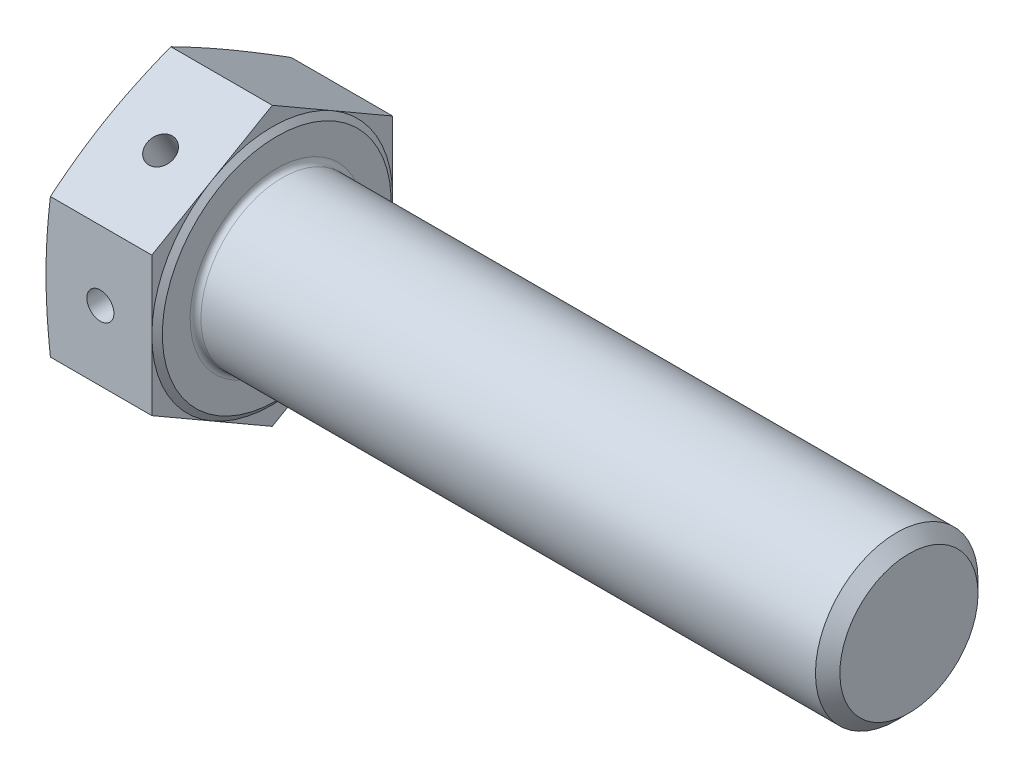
SolidWorks part; units mm, degrees
ref_plane "Front" through (0, 0, 0) normal (0, 0, 1) x (1, 0, 0)
ref_plane "Top" through (0, 0, 0) normal (0, 1, 0) x (1, 0, 0)
ref_plane "Right" through (0, 0, 0) normal (1, 0, 0) x (0, 0, -1)
sketch "Sketch-BaseHead" plane through (0, 0, 0) normal (1, 0, 0) x (0, 0, -1)
  line L1 (0, -15.3979) -> (13.335, -7.699)
  line L2 (13.335, -7.699) -> (13.335, 7.699)
  line L3 (13.335, 7.699) -> (0, 15.3979)
  line L4 (0, 15.3979) -> (-13.335, 7.699)
  line L5 (-13.335, 7.699) -> (-13.335, -7.699)
  line L6 (-13.335, -7.699) -> (0, -15.3979)
  circle A0 centre (0, 0) radius 13.335 construction
  dimension "s" = 26.67
extrude "BaseHead" add sketch "Sketch-BaseHead" along normal blind 11.72
sketch "Sketch4" plane through (-0.2646, -5.9169, 0) normal (0, 0, 1) x (0, 1, 0)
  line L0 (5.9169, 3.7369) -> (5.9169, -10.4477) construction
  line L2 (21.3148, -0.2646) -> (19.2519, -0.2646)
  line L4 (19.2519, -0.2646) -> (21.3148, -0.7536)
  line L6 (21.3148, -0.7536) -> (21.3148, -0.2646)
  dimension "D1" = 13.335
  dimension "D2" = 26.67
revolve "HeadChamfer" cut sketch "Sketch4" angle 360 about L0
sketch "Sketch2" plane through (0, 0, 0) normal (0, 1, 0) x (1, 0, 0)
  line L0 (11.72, 0) -> (12.22, 0)
  line L1 (12.22, 0) -> (12.22, 12.67)
  line L2 (12.22, 12.67) -> (11.72, 13.335)
  line L3 (11.72, 13.335) -> (11.72, 0)
  line L4 (11.72, 13.335) -> (11.72, 0) construction
  dimension "D1" = 13.335
  dimension "D2" = 12.67
  dimension "c" = 0.5
revolve "Revolve1" add sketch "Sketch2" angle 360 about axis through (-4.0016, 0, 0) along (1, 0, 0)
ref_plane "Plane2" through (40.22, 0, 0) normal (1, 0, 0) x (0, 0, -1)
sketch "Sketch3" plane through (12.22, 0, 0) normal (1, 0, 0) x (0, 0, -1)
  circle A0 centre (0, 0) radius 9
  dimension "d" = 18
extrude "BaseBody" add sketch "Sketch3" along normal blind 70
chamfer "Chamfer1" distance 1.353 angle 45 1 edges at (82.22, 9, 0)
fillet "HeadFillet" radius 0.6 1 edges at (12.22, -9, 0)
sketch "Sketch5" plane through (0, 0, 0) normal (0, 0, 1) x (1, 0, 0)
  line L1 (11.72, -11.5484) -> (11.72, -15.3979) construction
  line L2 (-4.0016, 0) -> (10.1831, 0) construction
  circle A0 centre (6.02, 0) radius 1.5
  dimension "d1" = 3
  dimension "h" = 5.7
extrude "Hole" cut sketch "Sketch5" against normal through all and the other way through all
pattern_circular "CirPattern1" count 2 over 60 about axis through (82.22, 0, 0) along (-1, 0, 0) of "Hole"
equation "\"D1@Sketch4\" = \"s@Sketch-BaseHead\"/ 2 "
equation "\"D2@Sketch4\" = \"s@Sketch-BaseHead\""
equation "\"D1@Chamfer1\" =  ( \"d@Sketch3\" - \"D2@ThreadCosmetic1\" ) / 2 "
equation "\"b@ThreadCosmetic1\" = \"l@BaseBody\" - \"lg@Plane2\""
equation "\"D1@Sketch2\"=\"s@Sketch-BaseHead\"/2"
